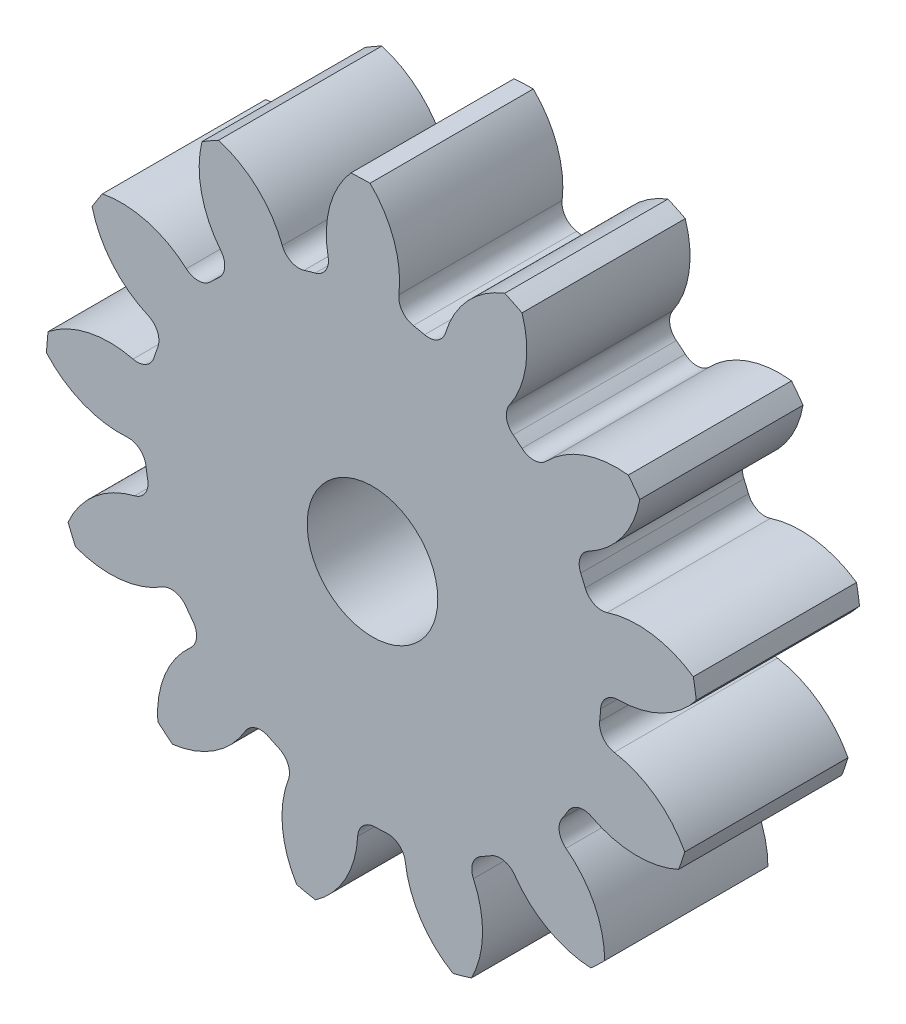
SolidWorks part; units mm, degrees
ref_plane "Front" through (0, 0, 0) normal (0, 0, 1) x (1, 0, 0)
ref_plane "Top" through (0, 0, 0) normal (0, 1, 0) x (1, 0, 0)
ref_plane "Right" through (0, 0, 0) normal (1, 0, 0) x (0, 0, -1)
sketch "Sketch3" plane through (0, 0, 0) normal (0, 0, 1) x (1, 0, 0)
  circle A0 centre (0, 0) radius 254
  dimension "od" = 508
extrude "gearBody" add sketch "Sketch3" along normal blind 127
sketch "Sketch2" plane through (0, 0, 0) normal (0, 0, 1) x (1, 0, 0)
  line L0 (0, 0) -> (191.1116, 79.161) construction
  line L1 (244.515, -77.3128) -> (0, 0) construction
  line L2 (0, 0) -> (36.3143, 0) construction
  line L3 (219.9822, 8.1555) -> (215.5215, -44.8237) construction
  line L5 (217.7519, -18.3341) -> (0, 0) construction
  line L7 (0, 0) -> (206.8577, 0) construction
  arc A0 (206.8163, 4.1366) -> (203.213, -38.6599) centre (0, 0) ccw construction
  arc A1 (251.9138, 32.4878) -> (242.9349, -74.1526) centre (0, 0) ccw construction
  arc A2 (219.9822, 8.1555) -> (215.5215, -44.8237) centre (0, 0) ccw construction
  arc A3 (176.7425, -19.3635) -> (177.4919, -10.4621) centre (0, 0) ccw
  arc A4 (244.515, -77.3128) -> (188.1184, -34.4507) centre (175.1846, -110.0021) ccw
  arc A5 (244.515, -77.3128) -> (254, 35.3393) centre (0, 0) ccw
  arc A6 (254, 35.3393) -> (191.2304, 2.5106) centre (191.1116, 79.161) cw
  arc A7 (177.4919, -10.4621) -> (191.2304, 2.5106) centre (191.2518, -11.2731) cw
  arc A8 (188.1184, -34.4507) -> (176.7425, -19.3635) centre (190.4442, -20.8646) cw
  point P6 (254, 35.3393)
  point P22 (244.515, -77.3128)
  dimension "baseDia" = 413.7153
  dimension "od" = 508
  dimension "pd" = 440.2667
  dimension "rd" = 355.6
  dimension "rFillet" = 13.7837
  dimension "pointX" = 254
  dimension "pointY" = 35.3393
  dimension "CTT" = 52.9791
  dimension "flankCenterAngle" = 22.5
extrude "toothCut" cut sketch "Sketch2" along normal through all
pattern_circular "CirPattern1" count 13 over 360 about axis through (0, 0, 0) along (0, 0, 1) of "toothCut"
sketch "hub1Dia" plane through (0, 0, 0) normal (0, 0, -1) x (-1, 0, 0)
  circle A0 centre (0, 0) radius 12.7
  dimension "hub1Dia" = 25.4
sketch "hub2Dia" plane through (0, 0, 127) normal (0, 0, 1) x (1, 0, 0)
  circle A0 centre (0, 0) radius 12.7
  dimension "hub2dia" = 25.4
sketch "boreDia" plane through (0, 0, 0) normal (0, 0, 1) x (1, 0, 0)
  circle A0 centre (0, 0) radius 50.8
  dimension "boreDia" = 101.6
extrude "bore" cut sketch "boreDia" against normal mid plane 25400
